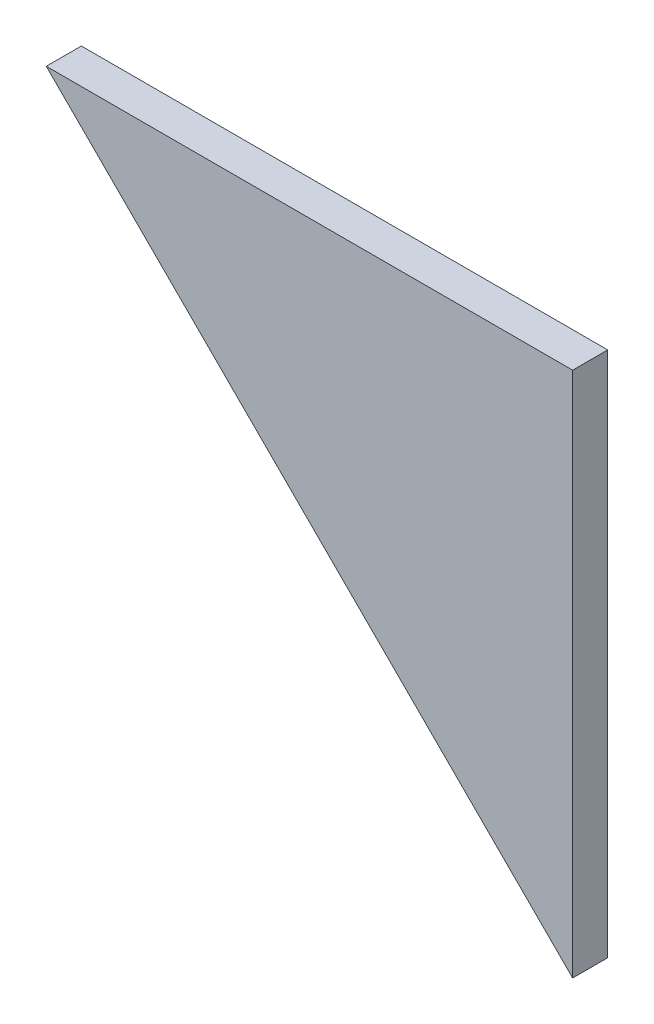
SolidWorks part; units mm, degrees
ref_plane "Plan de face" through (0, 0, 0) normal (0, 0, 1) x (1, 0, 0)
ref_plane "Plan de dessus" through (0, 0, 0) normal (0, 1, 0) x (1, 0, 0)
ref_plane "Plan de droite" through (0, 0, 0) normal (1, 0, 0) x (0, 0, -1)
sketch "Esquisse1" plane through (0, 0, 0) normal (0, 0, 1) x (1, 0, 0)
  line L0 (0, 0) -> (150, 0)
  line L1 (150, 0) -> (150, -150)
  line L2 (150, -150) -> (0, 0)
  dimension "D1" = 150
  dimension "D2" = 150
extrude "Boss.-Extru.1" add sketch "Esquisse1" along normal blind 10
